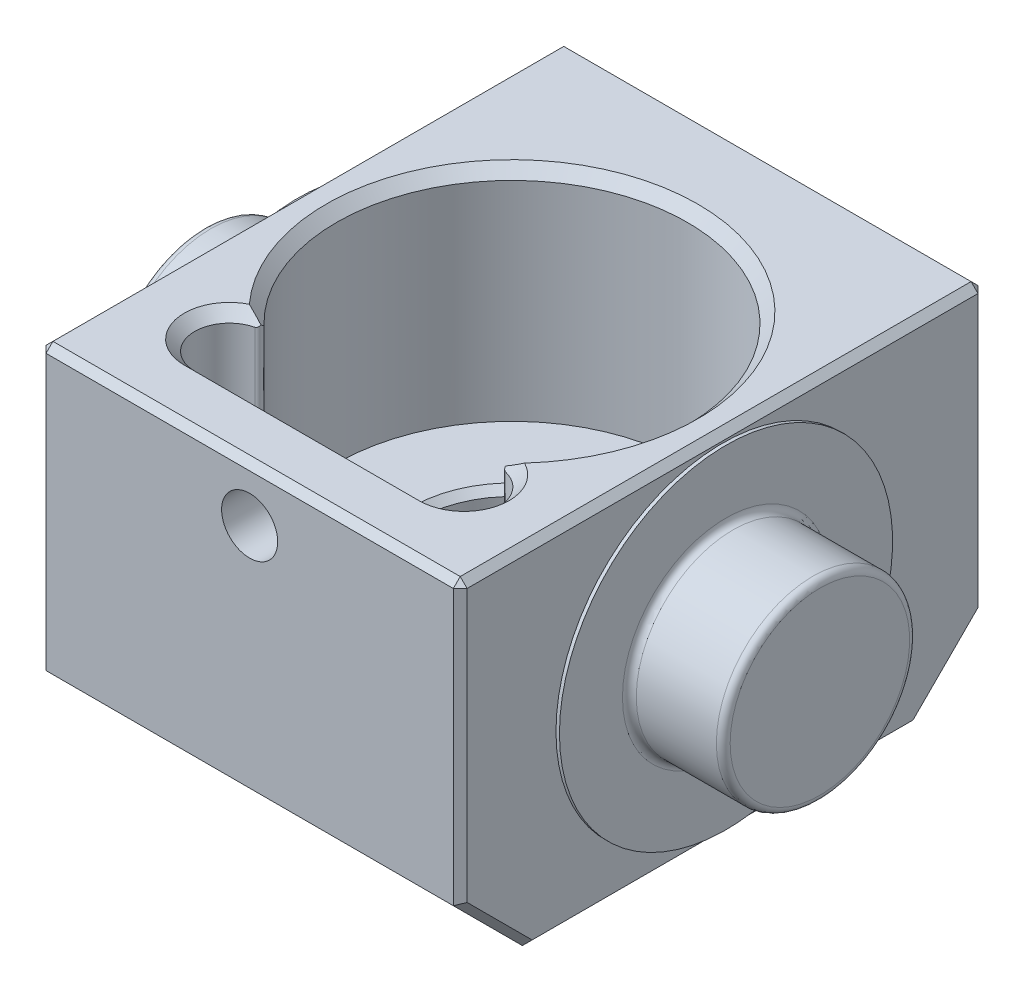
SolidWorks part; units mm, degrees
ref_plane "Front Plane" through (0, 0, 0) normal (0, 0, 1) x (1, 0, 0)
ref_plane "Top Plane" through (0, 0, 0) normal (0, 1, 0) x (1, 0, 0)
ref_plane "Right Plane" through (0, 0, 0) normal (1, 0, 0) x (0, 0, -1)
sketch "Sketch1" plane through (0, 0, 0) normal (1, 0, 0) x (0, 0, -1)
  line L1 (-19, 12.7) -> (19, 12.7)
  line L2 (-19, 12.7) -> (-19, -12.7)
  line L3 (-19, -12.7) -> (19, -12.7)
  line L4 (19, 12.7) -> (19, -12.7)
  line L5 (-19, 12.7) -> (19, -12.7) construction
  line L6 (-19, -12.7) -> (19, 12.7) construction
  point P0 (0, 0)
  dimension "D1" = 25.4
  dimension "D2" = 38
extrude "Boss-Extrude1" add sketch "Sketch1" along normal mid plane 30.5
sketch "Sketch2" plane through (0, 0, 0) normal (0, 0, 1) x (1, 0, 0)
  line L0 (0, 0) -> (15.0375, 0) construction
  line L1 (15.25, 12.065) -> (15.5, 12.065)
  line L2 (15.25, 12.7) -> (15.25, -12.7) construction
  line L3 (15.5, 12.065) -> (15.5, 7)
  line L4 (15.5, 7) -> (22.3, 7)
  line L5 (22.3, 7) -> (22.3, 0)
  line L6 (22.3, 0) -> (15.25, 0)
  line L7 (15.25, 0) -> (15.25, 12.065)
  line L8 (0, 10.193) -> (0, -1.9896) construction
  dimension "D1" = 24.13
  dimension "D2" = 31
  dimension "D3" = 14
  dimension "D4" = 44.6
revolve "Revolve1" add sketch "Sketch2" angle 360 about L0
mirror "Mirror1" about plane through (0, 0, 0) normal (1, 0, 0) of "Revolve1"
sketch "Sketch3" plane through (0, 0, 0) normal (0, 0, 1) x (1, 0, 0)
  line L0 (0, 12.7) -> (0, -3.175)
  line L1 (15.25, 12.7) -> (-15.25, 12.7) construction
  line L2 (0, -3.175) -> (-12.7038, -3.175)
  line L3 (-12.7038, -3.175) -> (-12.7038, 12.7)
  line L4 (-12.7038, 12.7) -> (0, 12.7)
  line L5 (0, 10.1247) -> (0, -4.0859) construction
  dimension "D1" = 25.4076
  dimension "D2" = 3.175
revolve "Cut-Revolve1" cut sketch "Sketch3" angle 360 about L5
sketch "Sketch4" plane through (0, 0, 0) normal (0, 0, 1) x (1, 0, 0)
  line L0 (0, -12.7) -> (0, -3.175)
  line L1 (15.25, -12.7) -> (-15.25, -12.7) construction
  line L2 (0, -12.7) -> (-10.3251, -12.7)
  line L3 (-6.7437, -9.525) -> (-6.7437, -3.175)
  line L4 (12.7038, -3.175) -> (-12.7038, -3.175) construction
  line L5 (-6.7437, -3.175) -> (0, -3.175)
  line L6 (0, -1.9252) -> (0, -15.9895) construction
  line L7 (-6.7437, -9.525) -> (-10.3251, -9.525)
  line L8 (-10.3251, -9.525) -> (-10.3251, -12.7)
  dimension "D1" = 13.4874
  dimension "D2" = 3.175
  dimension "D3" = 20.6502
revolve "Cut-Revolve2" cut sketch "Sketch4" angle 360 about L6
sketch "Sketch5" plane through (0, 12.7, 0) normal (0, 1, 0) x (1, 0, 0)
  line L0 (-8.5, -11.9729) -> (8.5, -11.9729) construction
  line L1 (-8.5, -9.4729) -> (8.5, -9.4729)
  line L2 (-8.5, -14.4729) -> (8.5, -14.4729)
  line L3 (-1.1729, 0) -> (1.6976, 0) construction
  arc A0 (-8.5, -9.4729) -> (-8.5, -14.4729) centre (-8.5, -11.9729) ccw
  arc A1 (8.5, -14.4729) -> (8.5, -9.4729) centre (8.5, -11.9729) ccw
  circle A4 centre (0, 0) radius 12.7038 construction
  point P2 (0, -11.9729)
  dimension "D1" = 22.1767
  dimension "D2" = 9.4729
  dimension "D3" = 5
  dimension "D4" = 17
extrude "Cut-Extrude1" cut sketch "Sketch5" against normal blind 6.5
chamfer "Chamfer1" distance 5 angle 45 2 edges at (0, -12.7, -19) (0, -12.7, 19)
chamfer "Chamfer2" distance 0.5 angle 45 14 edges at (15.25, -10.2, 16.5) (15.25, 2.5, 19) (15.25, -12.7, 0) (15.25, -10.2, -16.5) (15.25, 2.5, -19) (-15.25, 2.5, 19) (-15.25, -10.2, 16.5) (-15.25, -12.7, 0) (-15.25, -10.2, -16.5) (-15.25, 2.5, -19) (0, 12.7, -19) (15.25, 12.7, 0) (0, 12.7, 19) (-15.25, 12.7, 0)
chamfer "Chamfer4" distance 0.762 angle 45 6 edges at (-8.4823, 12.7, 9.4729) (-11, 12.7, 11.9729) (0, 12.7, 14.4729) (11, 12.7, 11.9729) (8.4823, 12.7, 9.4729) (0, 12.7, -12.7038)
fillet "Fillet1" radius 0.3 2 edges at (8.4647, 9.069, 9.4729) (-8.4647, 9.069, 9.4729)
chamfer "Chamfer5" distance 0.5 angle 45 3 edges at (0, -3.175, 6.7437) (0, -9.525, 6.7437) (0, -12.7, 10.3251)
fillet "Fillet2" radius 0.5 2 edges at (-22.3, 0, 7) (22.3, 0, 7)
fillet "Fillet3" radius 0.5 2 edges at (15.5, 0, 7) (-15.5, 0, 7)
sketch "Sketch9" plane through (0, 0, 19) normal (0, 0, 1) x (1, 0, 0)
  line L0 (0, 6.2) -> (0, 12.7) construction
  line L1 (-8.5, 6.2) -> (8.5, 6.2) construction
  line L2 (-14.75, 12.7) -> (14.75, 12.7) construction
  circle A0 centre (0, 8.76) radius 2.032
  circle A1 centre (0, 8.76) radius 3.3274 construction
  dimension "D1" = 4.064
  dimension "D2" = 6.6548
  dimension "D3" = 3.94
extrude "Cut-Extrude2" cut sketch "Sketch9" against normal up to next
